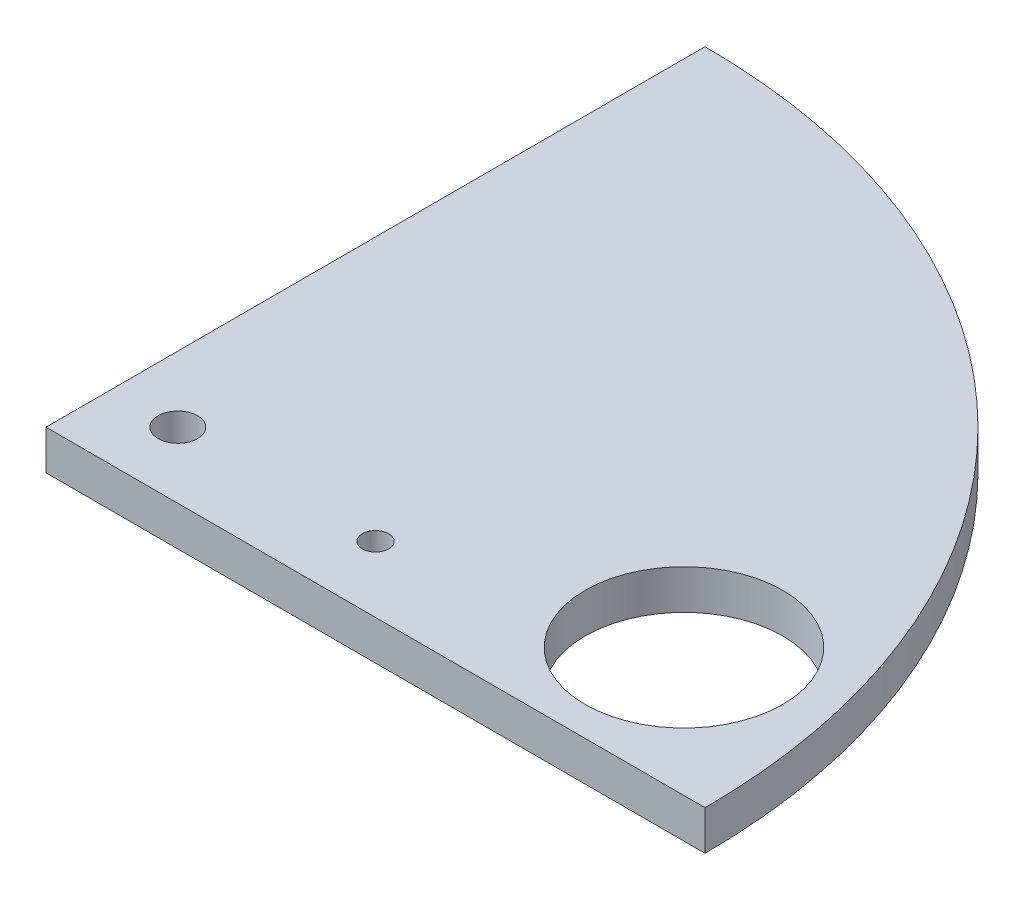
SolidWorks part; units mm, degrees
ref_plane "Front Plane" through (0, 0, 0) normal (0, 0, 1) x (1, 0, 0)
ref_plane "Top Plane" through (0, 0, 0) normal (0, 1, 0) x (1, 0, 0)
ref_plane "Right Plane" through (0, 0, 0) normal (1, 0, 0) x (0, 0, -1)
sketch "Sketch1" plane through (0, 0, 0) normal (0, 1, 0) x (1, 0, 0)
  line L0 (0, 0) -> (0, 50)
  line L1 (0, 0) -> (50, 0)
  line L2 (0, 0) -> (48.0631, 13.7819) construction
  line L3 (0, 0) -> (12.941, 48.2963) construction
  line L4 (0, 0) -> (35.3553, 35.3553) construction
  line L5 (5, 5) -> (48.7415, 11.1475) construction
  line L6 (5, 5) -> (11.1475, 48.7415) construction
  arc A0 (50, 0) -> (0, 50) centre (0, 0) ccw
  circle A1 centre (38.6691, 9.7319) radius 7.5
  circle A2 centre (5, 5) radius 1.5
  circle A3 centre (20, 5) radius 1
  dimension "D1" = 50
  dimension "D4" = 15
  dimension "D6" = 8
  dimension "D3" = 15
  dimension "D7" = 3
  dimension "D9" = 5
  dimension "D12" = 15
  dimension "D13" = 5
  dimension "D14" = 2
  dimension "D2" = 16
  dimension "D5" = 45
  dimension "D8" = 5
  dimension "D10" = 8
  dimension "D11" = 34
extrude "Boss-Extrude1" add sketch "Sketch1" along normal blind 3
